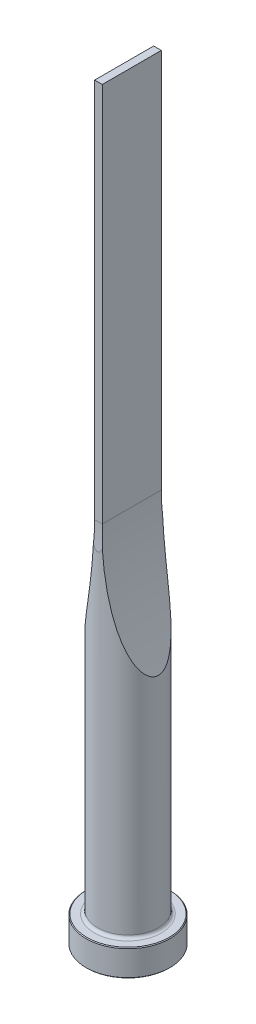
SolidWorks part; units mm, degrees
ref_plane "Front Plane" through (0, 0, 0) normal (0, 0, 1) x (1, 0, 0)
ref_plane "Top Plane" through (0, 0, 0) normal (0, 1, 0) x (1, 0, 0)
ref_plane "Right Plane" through (0, 0, 0) normal (1, 0, 0) x (0, 0, -1)
sketch "Sketch1" plane through (0, 0, 0) normal (0, 0, 1) x (1, 0, 0)
  line L0 (0, 0) -> (10.8, 0)
  line L1 (55, 0) -> (-55, 0) construction
  line L2 (11, 0.2) -> (11, 6.8)
  line L3 (10.8, 7) -> (8.8, 7)
  line L4 (8, 7.8) -> (8, 200)
  line L5 (0, 200) -> (8, 200)
  line L6 (11, 6.8) -> (10.8, 7)
  line L7 (10.8, 0) -> (11, 0.2)
  line L8 (0, 200) -> (0, 0)
  arc A0 (8, 7.8) -> (8.8, 7) centre (8.8, 7.8) ccw
  point P1 (11, 0)
  point P6 (11, 7)
  dimension "D4" = 0.8
  dimension "D1" = 8
  dimension "D2" = 11
  dimension "D3" = 7
  dimension "D5" = 200
revolve "Revolve1" add sketch "Sketch1" angle 360 about L8
sketch "Sketch2" plane through (0, 0, 0) normal (0, 0, 1) x (1, 0, 0)
  line L0 (1, 200) -> (1, 100)
  line L1 (8, 200) -> (-8, 200) construction
  line L2 (-1, 200) -> (-1, 100)
  line L3 (8, 200) -> (8, 65.2006)
  line L4 (-8, 200) -> (-8, 65.2006)
  line L5 (0, -12.1) -> (0, 12.1) construction
  line L6 (8, 200) -> (1, 200)
  line L8 (-1, 200) -> (-8, 200)
  arc A0 (1, 100) -> (8, 65.2006) centre (91, 100) ccw
  arc A1 (-1, 100) -> (-8, 65.2006) centre (-91, 100) cw
  dimension "D4" = 90
  dimension "D1" = 100
  dimension "D2" = 2
  dimension "D3" = 1
extrude "Cut-Extrude1" cut sketch "Sketch2" against normal mid plane 20
sketch "Sketch3" plane through (0, 0, 0) normal (1, 0, 0) x (0, 0, -1)
  line L0 (7.75, 200) -> (7.75, 100)
  line L1 (-7.9373, 200) -> (7.9373, 200) construction
  line L2 (-7.75, 200) -> (-7.75, 100)
  line L3 (8, 200) -> (8, 93.2965)
  line L4 (7.75, 200) -> (8, 200)
  line L5 (0, 12.1) -> (0, -12.1) construction
  line L6 (-8, 200) -> (-8, 93.2965)
  line L8 (-7.75, 200) -> (-8, 200)
  arc A0 (7.75, 100) -> (8, 93.2965) centre (97.75, 100) ccw
  arc A1 (-7.75, 100) -> (-8, 93.2965) centre (-97.75, 100) cw
  dimension "D2" = 90
  dimension "D1" = 100
  dimension "D3" = 15.5
  dimension "D4" = 7.75
extrude "Cut-Extrude2" cut sketch "Sketch3" against normal mid plane 20
